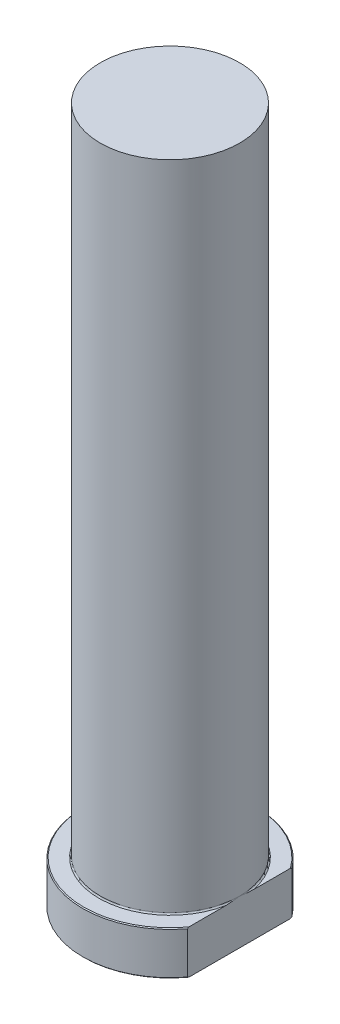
SolidWorks part; units mm, degrees
ref_plane "Front Plane" through (0, 0, 0) normal (0, 0, 1) x (1, 0, 0)
ref_plane "Top Plane" through (0, 0, 0) normal (0, 1, 0) x (1, 0, 0)
ref_plane "Right Plane" through (0, 0, 0) normal (1, 0, 0) x (0, 0, -1)
sketch "Sketch1" plane through (0, 0, 0) normal (0, 0, 1) x (1, 0, 0)
  line L0 (0, 259.9588) -> (0, -15.1925) construction
  line L1 (0, 0) -> (-20, 0)
  line L2 (-20, 0) -> (-20, 10)
  line L3 (-20, 10) -> (-16, 10)
  line L4 (-16, 10) -> (-16, 160)
  line L5 (-16, 160) -> (0, 160)
  line L6 (0, 160) -> (0, 0)
  dimension "L" = 160
  dimension "H" = 40
  dimension "T" = 10
  dimension "D" = 32
revolve "Revolve1" add sketch "Sketch1" angle 360 about L0
chamfer "Chamfer1" distance 0.2 angle 45 2 edges at (0, 10, 20) (0, 0, 20)
fillet "Fillet1" radius 0.3 1 edges at (0, 10, 16)
sketch "Sketch2" plane through (0, 0, 0) normal (0, 1, 0) x (1, 0, 0)
  line L0 (16, 12) -> (16, -12)
  circle A0 centre (0, 0) radius 20 construction
  arc A1 (16, -12) -> (16, 12) centre (0, 0) ccw
  circle A2 centre (0, 0) radius 16 construction
extrude "KEY" cut sketch "Sketch2" along normal through all
